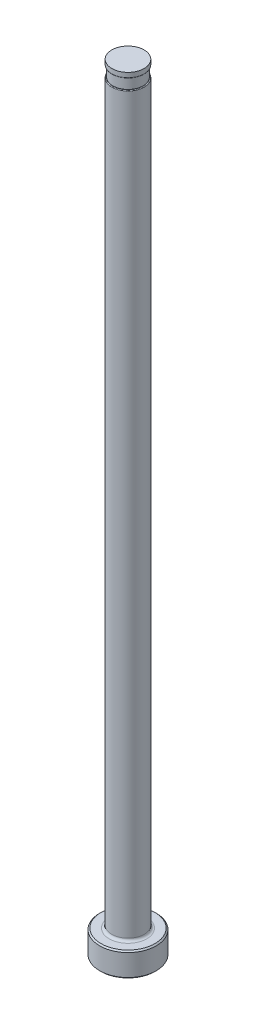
SolidWorks part; units mm, degrees
ref_plane "Front Plane" through (0, 0, 0) normal (0, 0, 1) x (1, 0, 0)
ref_plane "Top Plane" through (0, 0, 0) normal (0, 1, 0) x (1, 0, 0)
ref_plane "Right Plane" through (0, 0, 0) normal (1, 0, 0) x (0, 0, -1)
other "Configuration Table"
sketch "Sketch1" plane through (0, 0, 0) normal (0, 0, 1) x (1, 0, 0)
  line L0 (0, 259.9588) -> (0, -15.1925) construction
  line L1 (0, 0) -> (-5.5499, 0)
  line L2 (-5.5499, 0) -> (-5.5499, 4.7498)
  line L3 (-5.5499, 4.7498) -> (-3.175, 4.7498)
  line L4 (-3.175, 4.7498) -> (-3.175, 152.4)
  line L5 (-3.175, 152.4) -> (0, 152.4)
  line L6 (0, 152.4) -> (0, 0)
  dimension "L" = 152.4
  dimension "H" = 11.0998
  dimension "T" = 4.7498
  dimension "D" = 6.35
revolve "Revolve1" add sketch "Sketch1" angle 360 about L0
chamfer "Chamfer1" distance 0.254 angle 45 2 edges at (0, 4.7498, 5.5499) (0, 0, 5.5499)
fillet "Fillet1" radius 0.508 1 edges at (0, 4.7498, 3.175)
sketch "Sketch2" plane through (0, 0, 0) normal (0, 0, 1) x (1, 0, 0)
  line L0 (-3.175, 152.4) -> (-3.175, 5.2578) construction
  line L1 (-3.175, 151.384) -> (-2.9718, 151.384)
  line L2 (-3.175, 151.384) -> (-3.175, 149.352)
  line L3 (-3.175, 149.352) -> (-2.9718, 149.352)
  line L4 (-2.9718, 151.384) -> (-2.9718, 149.352)
  line L5 (3.175, 152.4) -> (-3.175, 152.4) construction
  line L6 (0, 153.4483) -> (0, 147.3282) construction
  dimension "D1" = 2.032
  dimension "N" = 1.016
  dimension "FD" = 0.2032
  dimension "D3" = 5.9436
revolve "Vent Relief" cut sketch "Sketch2" angle 360 about L6
sketch "Sketch3" plane through (0, 0, 0) normal (0, 0, 1) x (1, 0, 0)
  line L0 (-2.9718, 150.368) -> (-2.9718, 86.868)
  line L1 (-2.9718, 151.384) -> (-2.9718, 149.352) construction
  line L2 (-3.175, 149.352) -> (-3.175, 5.2578) construction
  line L3 (-3.175, 85.7504) -> (-3.175, 150.368)
  line L4 (-3.175, 150.368) -> (-2.9718, 150.368)
  arc A0 (-2.9718, 86.868) -> (-3.175, 85.7504) centre (-6.1468, 86.868) cw
  dimension "D1" = 3.175
  dimension "D2" = 63.5
extrude "D-Slot" cut sketch "Sketch3" against normal through all both and the other way through all
sketch "Sketch5" plane through (0, 0, 0) normal (0, 0, 1) x (1, 0, 0)
  line L0 (-3.175, 151.384) -> (3.175, 151.384) construction
  line L1 (-3.175, 152.4) -> (-3.1699, 152.4)
  line L2 (-3.175, 152.4) -> (-3.175, 151.384)
  line L3 (-3.175, 151.384) -> (-3.1699, 151.384)
  line L4 (-3.1699, 152.4) -> (-3.1699, 151.384)
  line L5 (0, 152.6877) -> (0, 150.5771) construction
  dimension "VP" = 0.0051
revolve "Vent Diameter" cut sketch "Sketch5" angle 360 about L5
fillet "Fillet2" radius 0.127 2 edges at (3.175, 149.352, 0) (0, 151.384, 3.1699)
sketch "Pocket Sketch" plane through (0, 0, 0) normal (0, 0, 1) x (1, 0, 0)
  line L0 (-5.9468, 0) -> (-5.9468, 4.7752)
  line L1 (-5.9468, 4.7752) -> (-4.1354, 4.7752)
  line L2 (-3.3734, 5.5372) -> (-3.3734, 22.225)
  line L3 (-3.3734, 22.225) -> (0, 22.225)
  line L4 (0, 22.225) -> (0, 0)
  line L5 (0, 0) -> (-5.9468, 0)
  line L6 (0, 12.6104) -> (0, -2.4989) construction
  line L7 (-5.5499, 4.4958) -> (-5.5499, 0.254) construction
  line L8 (5.2959, 4.7498) -> (-5.2959, 4.7498) construction
  line L9 (-3.175, 85.7504) -> (-3.175, 5.2578) construction
  line L10 (-4.1354, 4.7752) -> (-3.3734, 5.5372)
  point P3 (-3.3734, 4.7752)
  dimension "D1" = 11.8935
  dimension "D2" = 0.3969
  dimension "D3" = 0.0254
  dimension "D4" = 0.1984
  dimension "D5" = 6.7469
  dimension "D6" = 22.225
